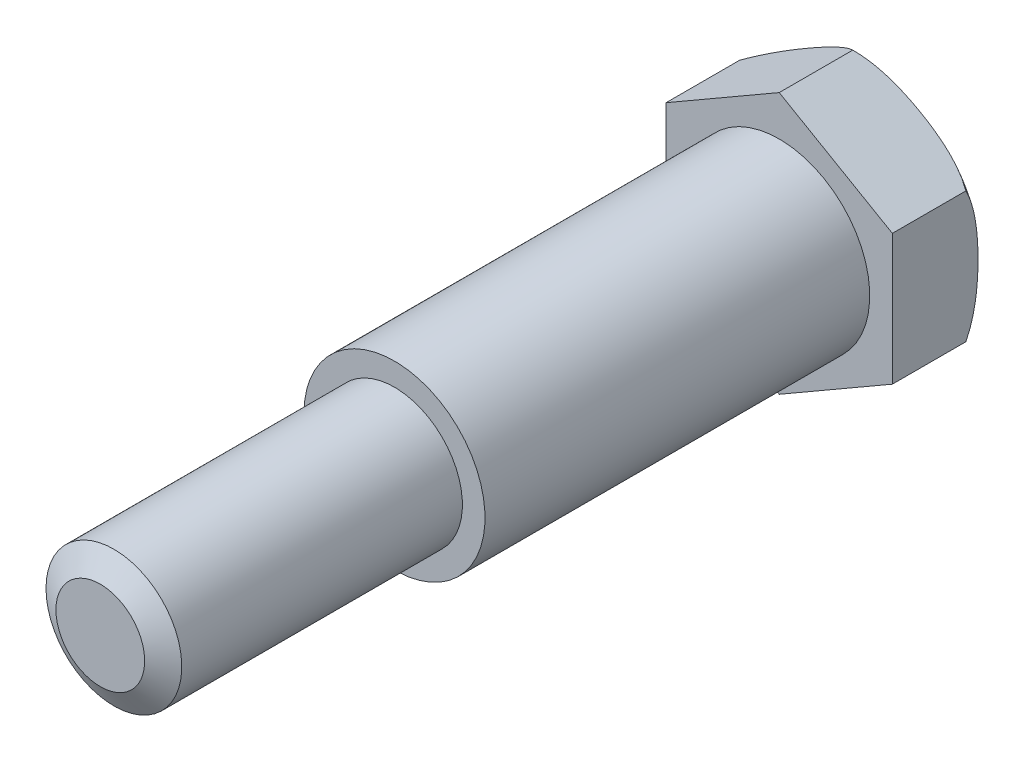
SolidWorks part; units mm, degrees
ref_plane "Plan1" through (0, 0, 0) normal (0, 0, 1) x (1, 0, 0)
ref_plane "Plan2" through (0, 0, 0) normal (0, 1, 0) x (1, 0, 0)
ref_plane "Plan3" through (0, 0, 0) normal (1, 0, 0) x (0, 0, -1)
sketch "Esquisse1" plane through (0, 0, 0) normal (0, 0, 1) x (1, 0, 0)
  line L1 (0, 5.7735) -> (-5, 2.8868)
  line L2 (-5, 2.8868) -> (-5, -2.8868)
  line L3 (-5, -2.8868) -> (0, -5.7735)
  line L4 (0, -5.7735) -> (5, -2.8868)
  line L5 (5, -2.8868) -> (5, 2.8868)
  line L6 (5, 2.8868) -> (0, 5.7735)
  circle A0 centre (0, 0) radius 5 construction
  dimension "D1" = 10
extrude "Base-Extrusion" add sketch "Esquisse1" along normal blind 4
sketch "Esquisse2" plane through (0, 0, 4) normal (0, 0, 1) x (1, 0, 0)
  circle A0 centre (0, 0) radius 4
  dimension "D1" = 8
extrude "Boss.-Extru.1" add sketch "Esquisse2" along normal blind 17
sketch "Esquisse3" plane through (0, 0, 21) normal (0, 0, 1) x (1, 0, 0)
  circle A0 centre (0, 0) radius 3
  dimension "D1" = 6
extrude "Boss.-Extru.2" add sketch "Esquisse3" along normal blind 13
chamfer "Chanfrein1" distance 0.6 angle 60
sketch "Esquisse4" plane through (0, 0, 0) normal (1, 0, 0) x (0, 0, -1)
  line L0 (0, 5.7735) -> (0, 2.8868) construction
  line L1 (0, 5.7735) -> (0, 3.9881)
  line L2 (-4, 5.7735) -> (0, 5.7735) construction
  line L3 (-0.75, 5.7735) -> (0, 5.7735)
  line L4 (0, 0) -> (-30, 0) construction
  arc A0 (0, 3.9881) -> (-0.75, 5.7735) centre (-2.5, 3.9881) ccw
  dimension "D2" = 2.5
  dimension "D1" = 0.75
revolve "Enlèvement de matière-Révolution1" cut sketch "Esquisse4" angle 360 about L4
